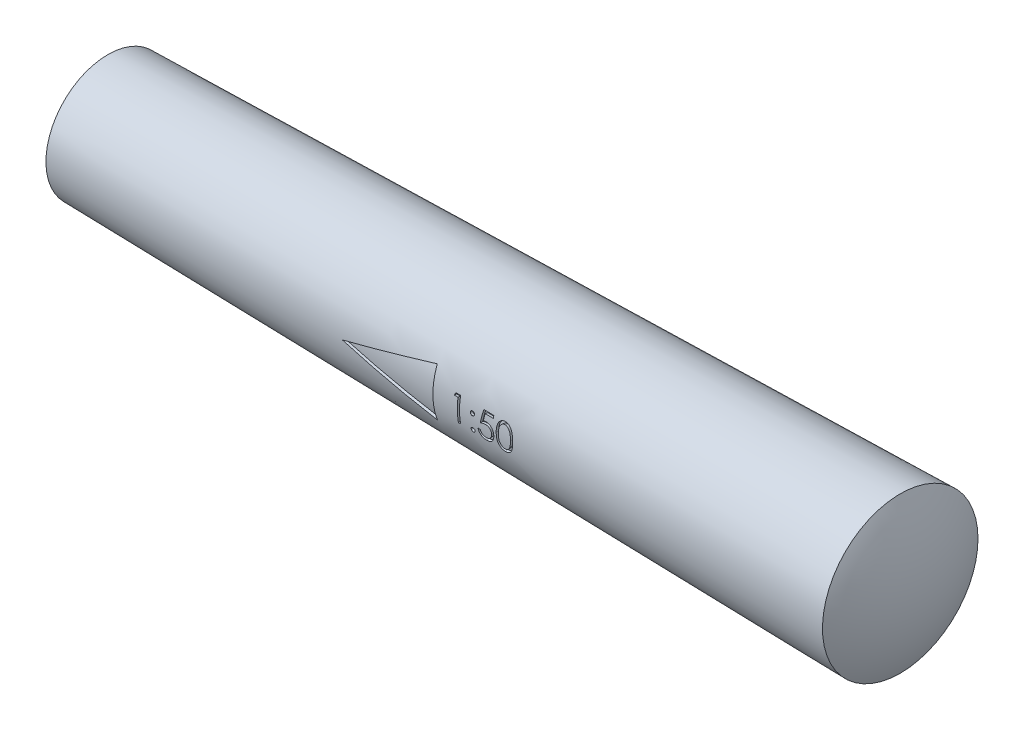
SolidWorks part; units mm, degrees
ref_plane "Front Plane" through (0, 0, 0) normal (0, 0, 1) x (1, 0, 0)
ref_plane "Top Plane" through (0, 0, 0) normal (0, 1, 0) x (1, 0, 0)
ref_plane "Right Plane" through (0, 0, 0) normal (1, 0, 0) x (0, 0, -1)
sketch "Sketch1" plane through (0, 0, 0) normal (1, 0, 0) x (0, 0, -1)
  circle A0 centre (0, 0) radius 2.5
  dimension "D1" = 5
extrude "Extrude1" add sketch "Sketch1" along normal mid plane 32
draft "Draft1" type of draft neutral plane draft angle 1.146 faces to draft 1 parameters "D1"=1.146
sketch "Sketch2" plane through (0, 0, 0) normal (0, 0, 1) x (1, 0, 0)
  line L0 (-16, 0) -> (-16, 2.5)
  line L1 (-16, 2.5) -> (-16, -2.5) construction
  line L2 (-16, 0) -> (-16.75, 0)
  line L3 (-16.75, 0) -> (-16.75, -2.82) construction
  line L4 (16, 0) -> (16, 3.14)
  line L5 (16, -3.14) -> (16, 3.14) construction
  line L6 (16, 0) -> (16.75, 0)
  line L7 (16.75, 0) -> (16.75, -2.82) construction
  line L8 (-16, -2.5) -> (16, -3.14) construction
  arc A0 (-16.75, 0) -> (-16, 2.5) centre (-12.2083, 0) cw
  arc A1 (16.75, 0) -> (16, 3.14) centre (9.8018, 0) ccw
  point P14 (0, -2.82)
revolve "Revolve1" add sketch "Sketch2" angle 360 about L2
sketch "Sketch5" plane through (0, 0, 0) normal (0, 0, 1) x (1, 0, 0)
  line L0 (0, 2.82) -> (0, -2.82) construction
  line L1 (16, 3.14) -> (-16, 2.5) construction
  line L2 (-16, -2.5) -> (16, -3.14) construction
ref_plane "Plane2" through (0, 0, 0) normal (-0.02, 0, 0.9998) x (0.9998, 0, 0.02)
sketch "Sketch6" plane through (0, 0, 0) normal (-0.02, 0, 0.9998) x (0.9998, 0, 0.02)
  line L0 (0, 0) -> (0, 1)
  line L1 (0, 2.82) -> (0, -2.82) construction
  line L2 (0, 1) -> (-3.7321, 0)
  line L3 (-3.7321, 0) -> (0, -1)
  line L4 (0, -1) -> (0, 0)
  line L5 (0, -0.5) -> (4, -0.5) construction
  text T0 "1:50" font "Century Gothic" height 1
  dimension "D1" = 2
  dimension "D2" = 30
  dimension "D3" = 4
wrap "Wrap2" sketch "Sketch6" wrap type deboss source sketch "Sketch6" thickness 0.1 parameters "D1"=0.1
equation "\"D2@Sketch2\" = \"D1@Sketch2\""
